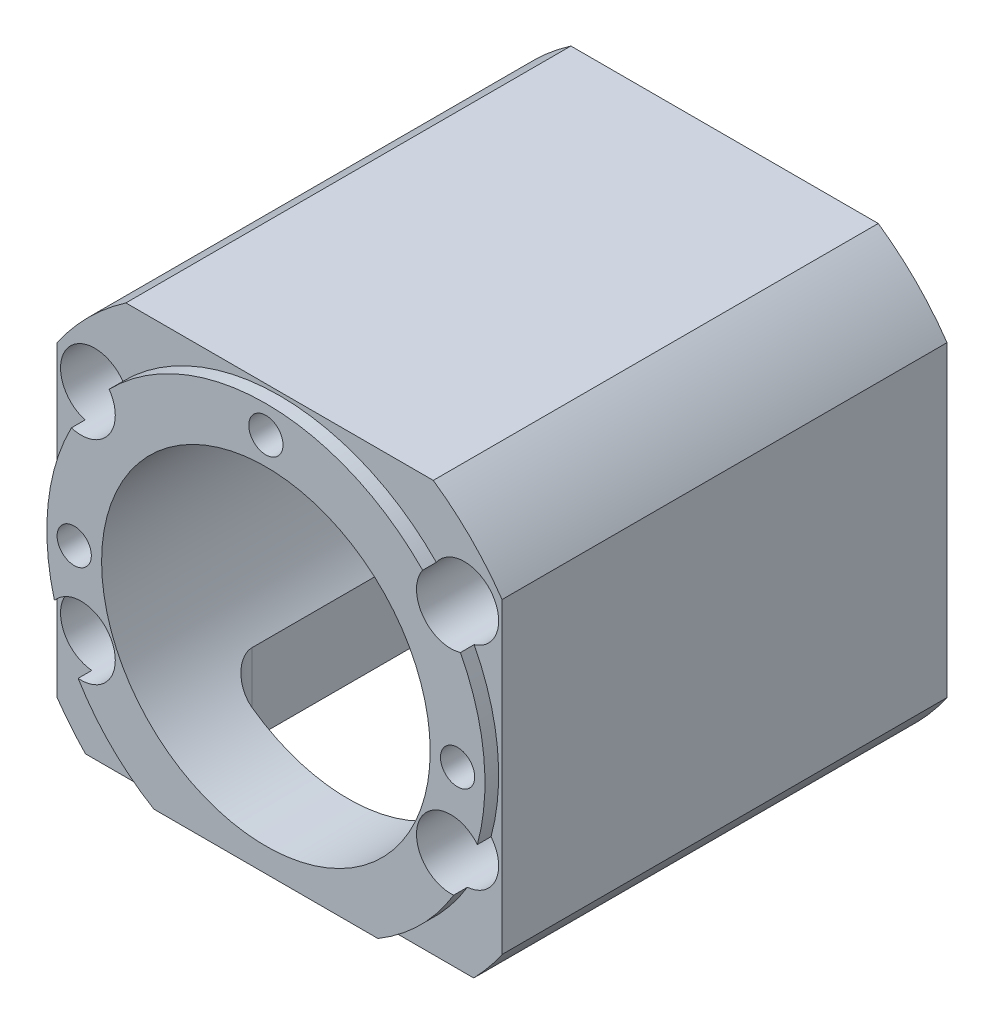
SolidWorks part; units mm, degrees
ref_plane "前视基准面" through (0, 0, 0) normal (0, 0, 1) x (1, 0, 0)
ref_plane "上视基准面" through (0, 0, 0) normal (0, 1, 0) x (1, 0, 0)
ref_plane "右视基准面" through (0, 0, 0) normal (1, 0, 0) x (0, 0, -1)
sketch "草图1" plane through (0, 0, 0) normal (0, 0, 1) x (1, 0, 0)
  line L1 (2.5766, 36.4821) -> (47.4765, 36.4821)
  line L2 (-7.4734, 26.432) -> (-7.4734, -18.4679)
  line L3 (2.5766, -28.5179) -> (47.4765, -28.5179)
  line L4 (57.5266, 26.432) -> (57.5266, -18.4679)
  line L5 (-2.9041, 31.9128) -> (52.9573, -23.9486) construction
  line L6 (-2.9041, -23.9486) -> (52.9573, 31.9128) construction
  arc A0 (-7.4734, -18.4679) -> (2.5766, -28.5179) centre (25.0266, 3.9821) ccw
  circle A1 centre (25.0266, 3.9821) radius 24
  arc A2 (47.4765, -28.5179) -> (57.5266, -18.4679) centre (25.0266, 3.9821) ccw
  arc A3 (57.5266, 26.432) -> (47.4765, 36.4821) centre (25.0266, 3.9821) ccw
  arc A4 (2.5766, 36.4821) -> (-7.4734, 26.432) centre (25.0266, 3.9821) ccw
  point P0 (25.0266, 3.9821)
  dimension "D1" = 39.5
  dimension "D3" = 65
  dimension "D5" = 32.5
  dimension "D2" = 65
  dimension "D4" = 32.5
extrude "凸台-拉伸1" add sketch "草图1" along normal blind 67
sketch "草图2" plane through (0, 0, 67) normal (0, 0, 1) x (1, 0, 0)
  circle A0 centre (25.0266, 3.9821) radius 59.2947
  circle A1 centre (25.0266, 3.9821) radius 32
  dimension "D1" = 64
extrude "切除-拉伸1" cut sketch "草图2" against normal blind 2
hole_wizard "M5 六角凹头螺钉的柱形沉头孔1" positions "草图4" profile "草图3" counterbore size "M5" standard "ISO"
sketch "草图4" plane through (0, 0, 67) normal (0, 0, 1) x (1, 0, 0)
  circle A0 centre (25.0266, 3.9821) radius 24 construction
  point P0 (-1.9734, 23.4821)
  point P2 (52.0266, 23.4821)
  point P4 (52.0266, -7.5179)
  point P6 (-1.9734, -7.5179)
  dimension "D1" = 27
  dimension "D2" = 19.5
  dimension "D3" = 27
  dimension "D4" = 11.5
sketch "草图3" plane through (-1.9734, 23.4821, 67) normal (1, 0, 0) x (0, -1, 0)
  line L0 (0, 0) -> (0, 67)
  line L1 (0, 67) -> (2.75, 67)
  line L3 (2.75, 67) -> (2.75, 44)
  line L4 (2.75, 44) -> (5, 44)
  line L5 (5, 44) -> (5, 0)
  line L7 (5, 0) -> (0, 0)
  line L11 (0, -6.35) -> (0, 107.95) construction
  dimension "通孔孔直径" = 5.5
  dimension "通孔孔深度" = 67
  dimension "柱形沉头孔直径" = 10
  dimension "柱形沉头孔深度" = 44
sketch "草图5" plane through (0, -28.5179, 0) normal (0, -1, 0) x (1, 0, 0)
  line L1 (81.9324, 90.1148) -> (-30.7656, 90.1148)
  line L2 (81.9324, 90.1148) -> (81.9324, -25.5953)
  line L3 (81.9324, -25.5953) -> (-30.7656, -25.5953)
  line L4 (-30.7656, 90.1148) -> (-30.7656, -25.5953)
  line L5 (81.9324, 90.1148) -> (-30.7656, -25.5953) construction
  line L6 (81.9324, -25.5953) -> (-30.7656, 90.1148) construction
  point P0 (25.5834, 32.2597)
extrude "切除-拉伸2" cut sketch "草图5" against normal blind 5
hole_wizard "M5 螺纹孔1" positions "草图7" profile "草图6" tap size "M5" standard "ISO"
sketch "草图7" plane through (0, 0, 67) normal (0, 0, 1) x (1, 0, 0)
  line L2 (25.0266, 35.9821) -> (25.0266, 3.9821)
  line L4 (57.0266, 3.9821) -> (-6.9734, 3.9821)
  circle A0 centre (25.0266, 3.9821) radius 24 construction
  arc A3 (47.9224, 26.3379) -> (2.1308, 26.3379) centre (25.0266, 3.9821) ccw construction
  arc A4 (55.9159, -4.3757) -> (53.4472, 18.6882) centre (25.0266, 3.9821) ccw construction
  arc A5 (-3.394, 18.6882) -> (-5.8627, -4.3757) centre (25.0266, 3.9821) ccw construction
  point P0 (-2.9734, 3.9821)
  point P2 (25.0266, 31.9821)
  point P4 (53.0266, 3.9821)
  dimension "D1" = 28
  dimension "D2" = 28
  dimension "D3" = 28
sketch "草图6" plane through (-2.9734, 3.9821, 67) normal (1, 0, 0) x (0, -1, 0)
  line L0 (0, 0) -> (0, 19.6618)
  line L1 (0, 19.6618) -> (2.1, 18.4)
  line L2 (2.1, 18.4) -> (2.1, 16)
  line L3 (2.1, 16) -> (2.5, 16)
  line L4 (2.5, 16) -> (2.5, 0)
  line L5 (2.5, 0) -> (0, 0)
  line L10 (0, 19.6618) -> (-2.1, 18.4) construction
  line L11 (0, -6.35) -> (0, 107.95) construction
  dimension "螺纹孔钻头直径" = 4.2
  dimension "螺纹孔钻头深度" = 18.4
  dimension "螺纹主直径" = 5
  dimension "螺纹深度" = 16
  dimension "导头角度" = 118
sketch "草图9" plane through (0, -23.5179, 0) normal (0, -1, 0) x (1, 0, 0)
  line L3 (41.3897, 67) -> (8.6635, 67) construction
  line L4 (25.0266, 67) -> (25.0266, 0) construction
  line L5 (53.3815, 0) -> (-3.3283, 0) construction
  line L7 (7.0266, 12) -> (43.0266, 12)
  line L8 (7.0266, 12) -> (7.0266, 55)
  line L9 (7.0266, 55) -> (43.0266, 55)
  line L10 (43.0266, 12) -> (43.0266, 55)
  line L11 (7.0266, 12) -> (43.0266, 55) construction
  line L12 (7.0266, 55) -> (43.0266, 12) construction
  point P15 (25.0266, 33.5)
  dimension "D5" = 36
  dimension "D6" = 12
  dimension "D7" = 12
extrude "切除-拉伸4" cut sketch "草图9" against normal blind 18
fillet "圆角1" radius 4 4 edges at (43.0266, -17.7052, 55) (7.0266, -17.7052, 55) (7.0266, -17.7052, 12) (43.0266, -17.7052, 12)
